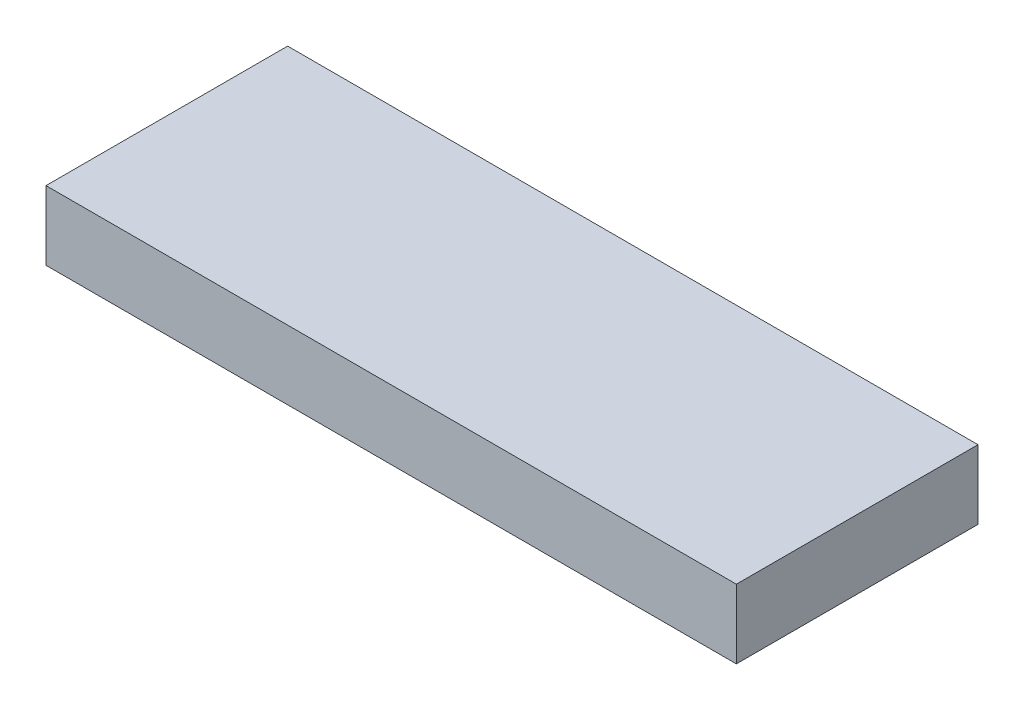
SolidWorks part; units mm, degrees
ref_plane "Front Plane" through (0, 0, 0) normal (0, 0, 1) x (1, 0, 0)
ref_plane "Top Plane" through (0, 0, 0) normal (0, 1, 0) x (1, 0, 0)
ref_plane "Right Plane" through (0, 0, 0) normal (1, 0, 0) x (0, 0, -1)
sketch "Sketch1" plane through (0, 0, 0) normal (0, 1, 0) x (1, 0, 0)
  line L1 (-500, -175) -> (500, -175)
  line L2 (-500, -175) -> (-500, 175)
  line L3 (-500, 175) -> (500, 175)
  line L4 (500, -175) -> (500, 175)
  line L5 (-500, -175) -> (500, 175) construction
  line L6 (-500, 175) -> (500, -175) construction
  point P0 (0, 0)
  dimension "D1" = 1000
  dimension "D2" = 350
extrude "Boss-Extrude1" add sketch "Sketch1" along normal blind 100
